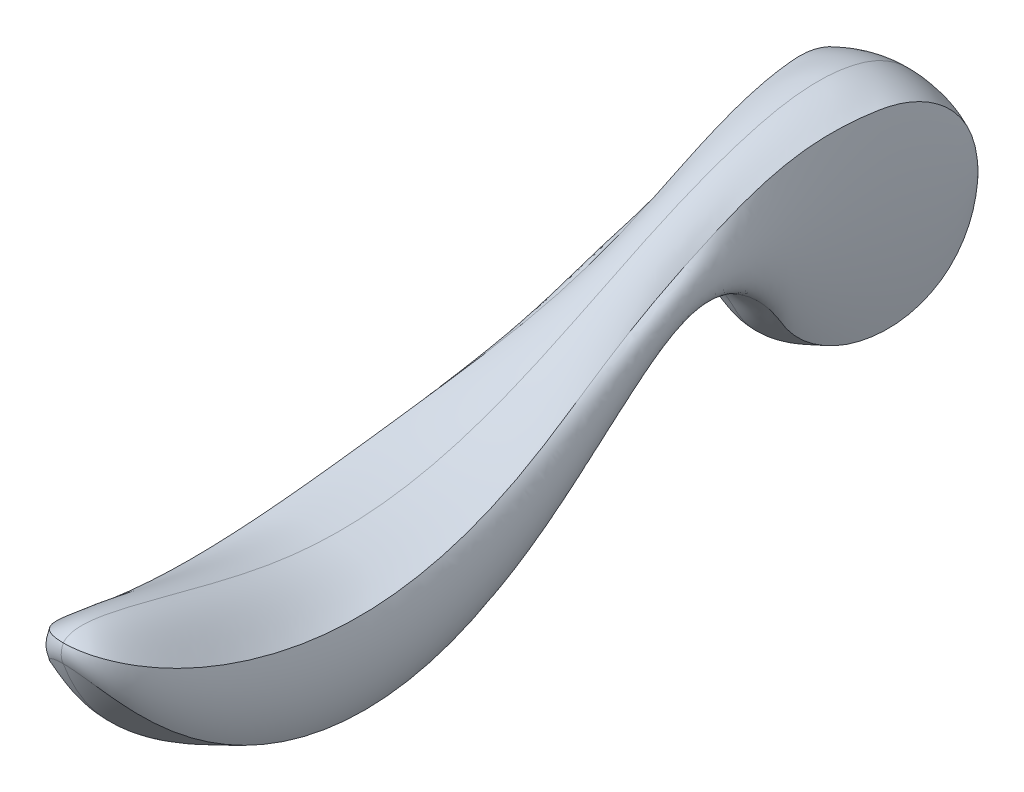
SolidWorks part; units mm, degrees
ref_plane "Front Plane" through (0, 0, 0) normal (0, 0, 1) x (1, 0, 0)
ref_plane "Top Plane" through (0, 0, 0) normal (0, 1, 0) x (1, 0, 0)
ref_plane "Right Plane" through (0, 0, 0) normal (1, 0, 0) x (0, 0, -1)
sketch "Size Reference Sketch" plane through (0, 0, 0) normal (1, 0, 0) x (0, 0, -1)
  line L0 (0, 0) -> (-127, 0) construction
  line L1 (-127, 11.2532) -> (-127, -11.2532) construction
  circle A0 centre (0, 0) radius 6.75
  circle A1 centre (0, 0) radius 16
  circle A2 centre (0, 0) radius 17.75
  dimension "D2" = 13.5
  dimension "D3" = 32
  dimension "D4" = 35.5
  dimension "D1" = 127
sketch "Side Profile" plane through (0, 0, 0) normal (1, 0, 0) x (0, 0, -1)
  line L0 (-127, 11.2532) -> (-127, -11.2532) construction
  circle A0 centre (0, 0) radius 16 construction
  arc A1 (-13.9055, -7.9144) -> (0.8317, 15.9784) centre (0, 0) ccw construction
  spline S0 degree 3 poles (-127, 0) (-94.7964, -17.4206) (-61.7723, -7.7469) (-10.0165, 16.5431) (0.8317, 15.9784) knots 0 0 0 0 0.853552 1 1 1 1 construction
  spline S1 degree 3 poles (-127, -3) (-105.2529, -32.7132) (-67.6804, -26.0266) (-26.9137, 4.5954) (-17.023, -2.4369) (-13.9055, -7.9144) knots 0 0 0 0 0.781831 0.894245 1 1 1 1 construction
  spline S2 degree 3 poles (-127, 0) (-94.7964, -17.4206) (-61.8094, -7.7578) (-10.1326, 16.4886) (0.6689, 15.9866) (0.7758, 15.9814) (0.9036, 15.9746) (0.9665, 15.9708) (1.0085, 15.9682) (1.0295, 15.9668) (14.5196, 15.0971) (20.7179, 3.0837) (13.6089, -8.4142) (6.4999, -19.9121) (-7.0171, -19.7358) (-13.8237, -8.0563) (-13.8457, -8.0186) (-13.8894, -7.9429) (-13.9543, -7.8288) (-13.998, -7.7532) (-17.1397, -2.3544) (-26.9661, 4.556) (-67.6804, -26.0266) (-105.2529, -32.7132) (-127, -3) knots 0 0 0 0 0.415603 0.486363 0.486363 0.486931 0.487069 0.487208 0.487346 0.487346 0.487346 0.54767 0.54767 0.54767 0.607994 0.607994 0.607994 0.608282 0.608571 0.608859 0.608859 0.649773 0.6938 1 1 1 1 weights 1 1 1 1 1 1 1 1 1 1 0.676498 0.676498 1 0.676498 0.676498 1 1 1 1 1 1 1 1 1 1
  dimension "D1" = 3
sketch "Top Profile" plane through (0, 0, 0) normal (0, 1, 0) x (1, 0, 0)
  line L0 (0, 0) -> (0, -127) construction
  line L1 (7.9597, 17.75) -> (0, 17.75) construction
  line L5 (5.0325, -127) -> (-5.0325, -127) construction
  spline S0 degree 3 poles (0, -127) (6.2907, -127) (12.0483, -100.1072) (10.6172, -59.473) (4.5853, -42.558) (5.1201, -9.2307) (8.8441, 10.4709) (7.9597, 17.75) knots 0 0 0 0 0.121336 0.332962 0.649497 0.826004 1 1 1 1
curve "Curve1"
sketch "Center Profile" plane through (0, 0, 0) normal (1, 0, 0) x (0, 0, -1)
  circle A0 centre (0, 0) radius 17.75 construction
  arc A1 (-15.9051, -7.8798) -> (4.7062, 17.1147) centre (0, 0) ccw construction
  spline S0 degree 3 poles (-127, 0) (-124.3061, 3.5614) (-87.2259, -11.7369) (-50.0619, -1.6202) (-21.9694, 15.3893) (-1.8602, 18.9204) (4.7062, 17.1147) knots 0 0 0 0 0.273377 0.579695 0.865956 1 1 1 1 construction
  spline S1 degree 3 poles (-127, -3) (-120.5366, -20.7728) (-90.606, -32.7132) (-49.0529, -16.3964) (-28.6498, 2.9839) (-19.7025, -0.2147) (-15.9051, -7.8798) knots 0 0 0 0 0.482227 0.772083 0.910513 1 1 1 1 construction
  spline S2 degree 3 poles (-127, 0) (-124.3061, 3.5614) (-87.2259, -11.7369) (-50.0619, -1.6202) (-22.6895, 14.9533) (-3.6349, 18.595) (2.5779, 17.6086) (3.7699, 17.3756) (5.5443, 16.8947) (6.6782, 16.457) (7.2324, 16.2097) (18.9305, 10.9903) (21.8391, -1.4849) (13.6555, -11.3397) (5.472, -21.1946) (-7.3252, -20.6275) (-14.605, -10.0874) (-15.0795, -9.4004) (-15.9316, -7.9594) (-17.0363, -5.7029) (-17.9383, -4.2934) (-21.2865, 0.2596) (-29.4446, 2.2289) (-49.0529, -16.3964) (-90.606, -32.7132) (-120.5366, -20.7728) (-127, -3) knots 0 0 0 0 0.096437 0.204495 0.305477 0.346192 0.346192 0.35054 0.354887 0.359235 0.359235 0.359235 0.426782 0.426782 0.426782 0.49433 0.49433 0.49433 0.500311 0.506292 0.512273 0.512273 0.546777 0.615683 0.759963 1 1 1 1 weights 1 1 1 1 1 1 1 1 1 1 1 0.736115 0.736115 1 0.736115 0.736115 1 1 1 1 1 1 1 1 1 1 1
sketch "Guide Curve" plane through (0, 0, 0) normal (0, 1, 0) x (1, 0, 0)
  line L2 (3.6365, 17.75) -> (-3.6365, 17.75) construction
  spline S0 degree 2 poles (0, 17.75) (4.5457, 17.75) (8.1188, 16.0005) knots 0 0 0 1 1 1
surface "Surface-Loft1"
sketch "Sketch7" plane through (0, 0, 0) normal (1, 0, 0) x (0, 0, -1)
  line L0 (-127, 0) -> (-127, -3) construction
  arc A0 (-127, 0) -> (-127, -3) centre (-123.9607, -1.5) ccw
  dimension "D1" = 0.35
surface "Surface-Extrude1" sketch "Sketch7" parameters "D1"=10
sketch "Sketch8" plane through (0, 0, 0) normal (0, 0, 1) x (1, 0, 0)
  line L0 (0, 0) -> (22.5217, 0)
sketch "Sketch9" plane through (0, 0, 0) normal (0, 0, 1) x (1, 0, 0)
  line L0 (7.0495, 16.0141) -> (7.0495, -16.0006) construction
  arc A0 (7.0495, 16.0141) -> (7.0495, -16.0006) centre (-94.8195, 0.0068) cw
  dimension "D1" = 1.25
ref_plane "Plane1" through (0, 0, 102) normal (0, 0, 1) x (1, 0, 0)
sketch "Sketch10" plane through (0, 0, 102) normal (0, 0, 1) x (1, 0, 0)
  line L0 (10.3591, -8.7059) -> (10.3585, -21.5895) construction
  arc A0 (10.3591, -8.7059) -> (10.3585, -21.5895) centre (-5.6148, -15.147) cw
  dimension "D1" = 1.25
other "Boundary-Surface1"
surface "Surface-Knit1"
other "Intersect1"
mirror "Mirror1" about plane through (0, 0, 0) normal (1, 0, 0)
